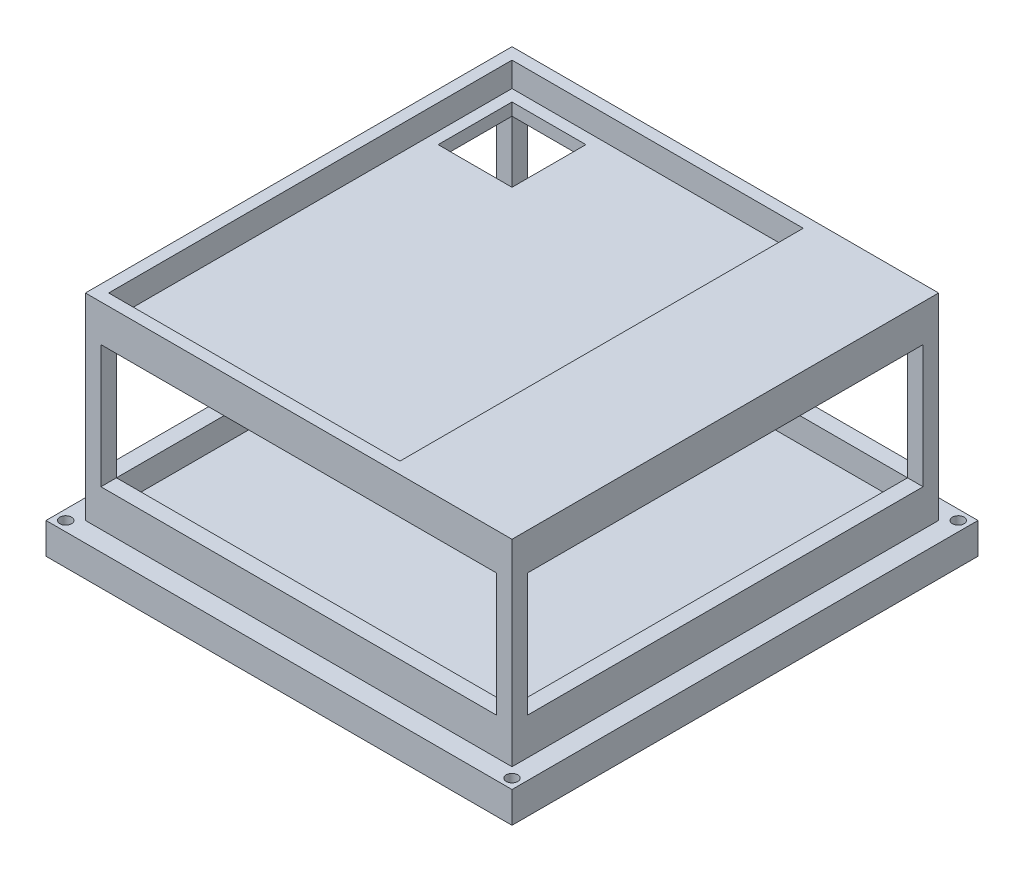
SolidWorks part; units mm, degrees
ref_plane "Front Plane" through (0, 0, 0) normal (0, 0, 1) x (1, 0, 0)
ref_plane "Top Plane" through (0, 0, 0) normal (0, 1, 0) x (1, 0, 0)
ref_plane "Right Plane" through (0, 0, 0) normal (1, 0, 0) x (0, 0, -1)
sketch "Sketch1" plane through (0, 0, 0) normal (0, 1, 0) x (1, 0, 0)
  line L1 (-55, -55) -> (55, -55)
  line L2 (-55, -55) -> (-55, 55)
  line L3 (-55, 55) -> (55, 55)
  line L4 (55, -55) -> (55, 55)
  line L5 (-55, -55) -> (55, 55) construction
  line L6 (-55, 55) -> (55, -55) construction
  point P0 (0, 0)
  dimension "D1" = 110
  dimension "D2" = 110
extrude "Boss-Extrude1" add sketch "Sketch1" along normal blind 9.525
sketch "Sketch3" plane through (0, 0, 0) normal (0, -1, 0) x (1, 0, 0)
  line L0 (55, 55) -> (55, -55) construction
  line L1 (-60.08, -60.08) -> (60.08, -60.08)
  line L2 (-60.08, -60.08) -> (-60.08, 60.08)
  line L3 (-60.08, 60.08) -> (60.08, 60.08)
  line L4 (60.08, -60.08) -> (60.08, 60.08)
  line L5 (-60.08, -60.08) -> (60.08, 60.08) construction
  line L6 (-60.08, 60.08) -> (60.08, -60.08) construction
  line L7 (-55, 55) -> (55, 55) construction
  point P0 (0, 0)
  dimension "D1" = 5.08
  dimension "D2" = 5.08
extrude "Boss-Extrude2" add sketch "Sketch3" along normal blind 8
sketch "Sketch4" plane through (0, 0, 0) normal (0, 1, 0) x (1, 0, 0)
  line L0 (-60.08, 60.08) -> (-55, 60.08) construction
  line L1 (-55, 55) -> (-55, 60.08) construction
  line L2 (-60.08, 60.08) -> (60.08, 60.08) construction
  line L3 (0, -9.6387) -> (0, 9.6387) construction
  line L4 (55, 55) -> (55, 60.08) construction
  line L5 (60.08, 60.08) -> (55, 60.08) construction
  line L6 (-9.6387, 0) -> (9.6387, 0) construction
  line L7 (60.08, -60.08) -> (55, -60.08) construction
  line L8 (55, -55) -> (55, -60.08) construction
  line L9 (-55, -55) -> (-55, -60.08) construction
  line L10 (-60.08, -60.08) -> (-55, -60.08) construction
  line L11 (-60.08, -60.08) -> (-60.08, 60.08) construction
  circle A0 centre (-57.54, 57.54) radius 1.5
  circle A1 centre (57.54, 57.54) radius 1.5
  circle A2 centre (57.54, -57.54) radius 1.5
  circle A3 centre (-57.54, -57.54) radius 1.5
  point P8 (0, 0)
  point P10 (-57.54, 60.08)
  point P11 (-55, 57.54)
  dimension "D1" = 3
  dimension "D2" = 5.08
  dimension "D3" = 5.08
  dimension "D4" = 2.54
  dimension "D5" = 2.54
extrude "Cut-Extrude2" cut sketch "Sketch4" against normal through all
sketch "Sketch2" plane through (0, 9.525, 0) normal (0, 1, 0) x (1, 0, 0)
  line L1 (-51, -51) -> (51, -51)
  line L2 (-51, -51) -> (-51, 51)
  line L3 (-51, 51) -> (51, 51)
  line L4 (51, -51) -> (51, 51)
  line L5 (-51, -51) -> (51, 51) construction
  line L6 (-51, 51) -> (51, -51) construction
  point P0 (0, 0)
  dimension "D1" = 102
  dimension "D2" = 102
extrude "Cut-Extrude1" cut sketch "Sketch2" against normal blind 6.35
sketch "Sketch5" plane through (0, 9.525, 0) normal (0, 1, 0) x (1, 0, 0)
  line L0 (-9.6387, 0) -> (9.6387, 0) construction
  line L1 (-55, 55) -> (-51, 55)
  line L2 (-55, 55) -> (-55, 51)
  line L3 (-55, 51) -> (-51, 51)
  line L4 (-51, 55) -> (-51, 51)
  line L5 (-55, -51) -> (-51, -51)
  line L6 (-51, -55) -> (-51, -51)
  line L7 (-55, -55) -> (-51, -55)
  line L8 (-55, -55) -> (-55, -51)
  line L9 (0, -9.6387) -> (0, 9.6387) construction
  line L10 (55, -55) -> (55, -51)
  line L11 (55, -55) -> (51, -55)
  line L12 (51, -55) -> (51, -51)
  line L13 (55, -51) -> (51, -51)
  line L14 (55, 51) -> (51, 51)
  line L15 (51, 55) -> (51, 51)
  line L16 (55, 55) -> (51, 55)
  line L17 (55, 55) -> (55, 51)
extrude "Boss-Extrude3" add sketch "Sketch5" along normal blind 31.75
sketch "Sketch6" plane through (0, 41.275, 0) normal (0, 1, 0) x (1, 0, 0)
  line L1 (-55, 55) -> (55, 55)
  line L2 (-55, 55) -> (-55, -55)
  line L3 (-55, -55) -> (55, -55)
  line L4 (55, 55) -> (55, -55)
extrude "Boss-Extrude4" add sketch "Sketch6" along normal blind 9.525
sketch "Sketch7" plane through (0, 50.8, 0) normal (0, 1, 0) x (1, 0, 0)
  line L0 (55, 55) -> (-55, 55) construction
  line L1 (-52, 52) -> (23.1, 52)
  line L2 (-52, 52) -> (-52, -52)
  line L3 (-52, -52) -> (23.1, -52)
  line L4 (23.1, 52) -> (23.1, -52)
  line L5 (-55, 55) -> (-55, -55) construction
  line L6 (-55, -55) -> (55, -55) construction
  dimension "D1" = 75.1
  dimension "D2" = 3
  dimension "D3" = 3
  dimension "D4" = 3
extrude "Cut-Extrude3" cut sketch "Sketch7" against normal blind 6.35
sketch "Sketch8" plane through (0, 44.45, 0) normal (0, 1, 0) x (1, 0, 0)
  line L0 (23.1, 52) -> (-52, 52) construction
  line L1 (-49, 49) -> (-29.95, 49)
  line L2 (-49, 49) -> (-49, 29.95)
  line L3 (-49, 29.95) -> (-29.95, 29.95)
  line L4 (-29.95, 49) -> (-29.95, 29.95)
  line L5 (-52, 52) -> (-52, -52) construction
  dimension "D1" = 19.05
  dimension "D2" = 19.05
  dimension "D3" = 3
  dimension "D4" = 3
extrude "Cut-Extrude4" cut sketch "Sketch8" against normal up to next
